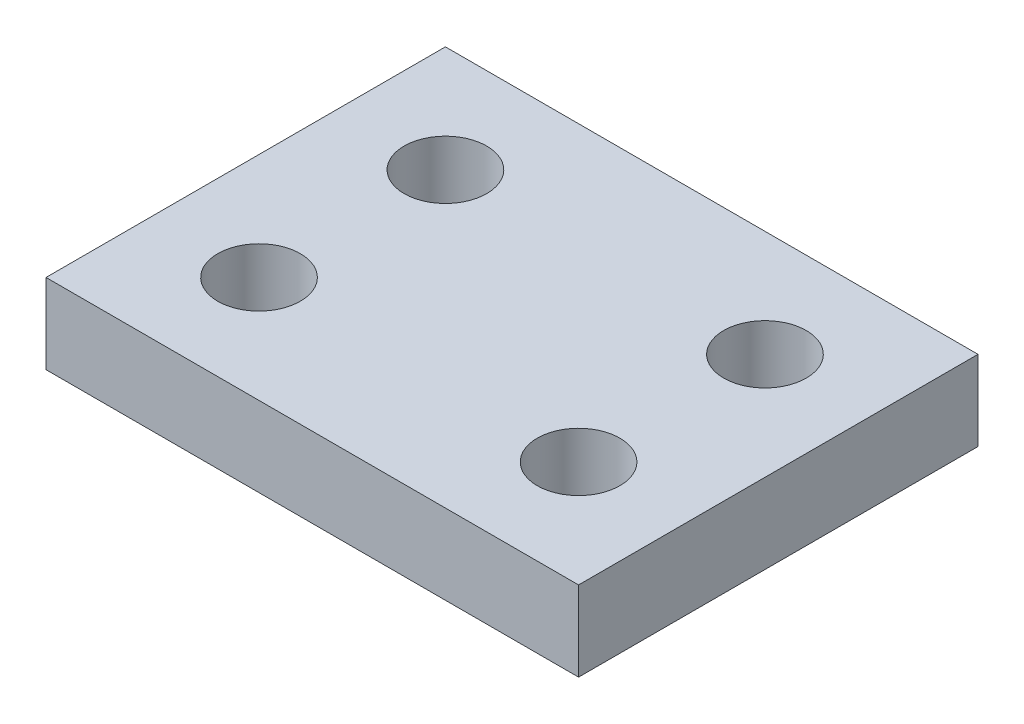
SolidWorks part; units mm, degrees
ref_plane "Front Plane" through (0, 0, 0) normal (0, 0, 1) x (1, 0, 0)
ref_plane "Top Plane" through (0, 0, 0) normal (0, 1, 0) x (1, 0, 0)
ref_plane "Right Plane" through (0, 0, 0) normal (1, 0, 0) x (0, 0, -1)
sketch "Sketch1" plane through (0, 0, 0) normal (0, 1, 0) x (1, 0, 0)
  line L1 (-50, -37.5) -> (50, -37.5)
  line L2 (-50, -37.5) -> (-50, 37.5)
  line L3 (-50, 37.5) -> (50, 37.5)
  line L4 (50, -37.5) -> (50, 37.5)
  line L5 (-50, -37.5) -> (50, 37.5) construction
  line L6 (-50, 37.5) -> (50, -37.5) construction
  point P0 (0, 0)
  dimension "D1" = 100
  dimension "D2" = 75
extrude "Boss-Extrude1" add sketch "Sketch1" along normal blind 15
hole_wizard "Ø15.5 (15.5) Diameter Hole1" positions "Sketch2" profile "Sketch3" hole size "Ø15.5" standard "ANSI Metric"
sketch "Sketch2" plane through (0, 15, 0) normal (0, 1, 0) x (-1, 0, 0)
  line L0 (50, 37.5) -> (-50, 37.5) construction
  line L1 (-50, -37.5) -> (50, -37.5) construction
  line L2 (-50, 37.5) -> (-50, -37.5) construction
  line L3 (50, -37.5) -> (50, 37.5) construction
  point P0 (30, 17.5)
  point P2 (30, -17.5)
  point P4 (-30, -17.5)
  point P6 (-30, 17.5)
  dimension "D1" = 20
  dimension "D2" = 20
  dimension "D3" = 20
  dimension "D4" = 20
  dimension "D5" = 20
sketch "Sketch3" plane through (-30, 15, 17.5) normal (1, 0, 0) x (0, 0, 1)
  line L0 (0, 0) -> (0, 15)
  line L1 (0, 15) -> (7.75, 15)
  line L2 (7.75, 15) -> (7.75, 0)
  line L5 (7.75, 0) -> (0, 0)
  line L11 (0, -6.35) -> (0, 107.95) construction
  dimension "Thru Hole Dia." = 15.5
  dimension "Thru Hole Depth" = 15
